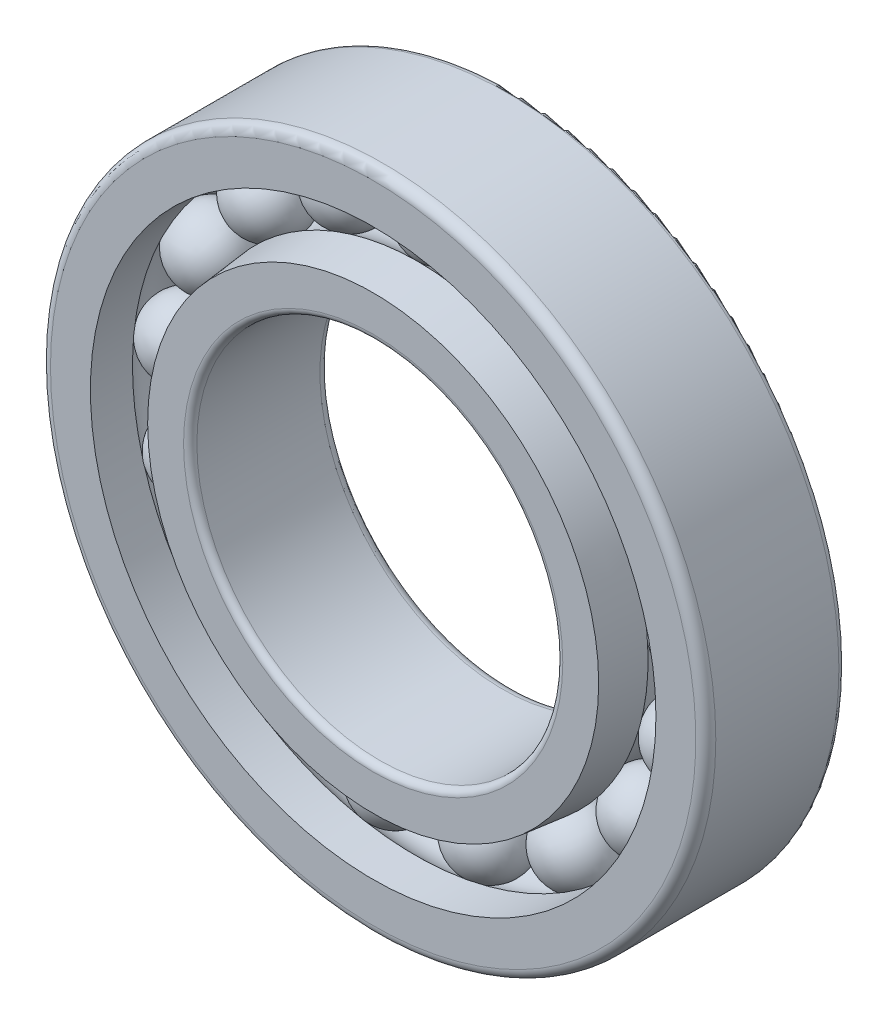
SolidWorks part; units mm, degrees
ref_plane "Front Plane" through (0, 0, 0) normal (0, 0, 1) x (1, 0, 0)
ref_plane "Top Plane" through (0, 0, 0) normal (0, 1, 0) x (1, 0, 0)
ref_plane "Right Plane" through (0, 0, 0) normal (1, 0, 0) x (0, 0, -1)
sketch "BaseSke" plane through (0, 0, 0) normal (1, 0, 0) x (0, 0, -1)
  line L0 (-47.2296, 0) -> (24.6132, 0) construction
  line L1 (-47.2296, 38.75) -> (24.6132, 38.75) construction
  line L2 (0, 129.5214) -> (0, -86.3012) construction
  line L3 (0, 44.375) -> (0, 33.125)
  line L4 (-10.5, 50) -> (10.5, 50) construction
  line L5 (-10.5, 27.5) -> (10.5, 27.5) construction
  arc A0 (0, 44.375) -> (0, 33.125) centre (0, 38.75) ccw
  dimension "Ball_diameter" = 11.25
  dimension "D1" = 38.75
  dimension "Bearing_Thickness" = 21
  dimension "Bearing_Outside_Diameter" = 100
  dimension "Bearing_Inside_Diameter" = 55
revolve "Ball" add sketch "BaseSke" angle 360 about L3
sketch "OuterRaceSke" plane through (0, 0, 0) normal (1, 0, 0) x (0, 0, -1)
  line L0 (0, 0) -> (0, 87.5396) construction
  line L1 (-10.5, 50) -> (10.5, 50)
  line L2 (-10.5, 50) -> (-10.5, 42.5)
  line L3 (-10.5, 42.5) -> (-4.1792, 42.5)
  line L4 (10.5, 50) -> (10.5, 43.6036)
  line L5 (-50.3916, 0) -> (55.2197, 0) construction
  line L6 (-47.2296, 38.75) -> (24.6132, 38.75) construction
  line L8 (10.5, 43.6036) -> (3.7847, 42.8978)
  line L9 (0, 42.5) -> (-4.1992, 58.1715) construction
  line L10 (0, 42.5) -> (3.7847, 42.8978) construction
  arc A0 (3.7847, 42.8978) -> (-4.1792, 42.5) centre (0, 38.75) ccw
  dimension "D4" = 11.23
  dimension "D2" = 85
  dimension "D3" = 6
  dimension "Angle" = 15
revolve "OuterRace" add sketch "OuterRaceSke" angle 360 about L5
sketch "InnerRaceSke" plane through (0, 0, 0) normal (1, 0, 0) x (0, 0, -1)
  line L0 (-70.8626, 0) -> (113.5527, 0) construction
  line L1 (0, 58.441) -> (0, -70.8113) construction
  line L2 (-10.5, 27.5) -> (10.5, 27.5)
  line L3 (-10.5, 27.5) -> (-10.5, 35)
  line L4 (-10.5, 35) -> (-4.1792, 35)
  line L5 (10.5, 27.5) -> (10.5, 35)
  line L6 (0, 129.5214) -> (0, -86.3012) construction
  line L7 (4.1792, 35) -> (10.5, 35)
  arc A0 (-4.1792, 35) -> (4.1792, 35) centre (0, 38.75) ccw
  arc A1 (0, 44.375) -> (0, 33.125) centre (0, 38.75) ccw construction
  dimension "D2" = 11.23
  dimension "D1" = 70
revolve "InnerRace" add sketch "InnerRaceSke" angle 360 about L0
fillet "Fillet1" radius 1.5 2 edges at (27.5, 0, -10.5) (50, 0, 10.5)
fillet "Fillet2" radius 1 2 edges at (50, 0, -10.5) (27.5, 0, 10.5)
sketch "CutInnerRaceSke" plane through (0, 0, 0) normal (1, 0, 0) x (0, 0, -1)
  line L0 (-4.1792, 35) -> (-10.5, 35)
  line L1 (-10.5, 35) -> (-10.5, 33.8964)
  line L2 (-10.5, 33.8964) -> (-3.7847, 34.6022)
  line L3 (-3.7847, 34.6022) -> (0, 35) construction
  line L4 (0, 58.441) -> (0, -70.8113) construction
  line L5 (-28.3066, 0) -> (35.2466, 0) construction
  arc A0 (-4.1792, 35) -> (-3.7847, 34.6022) centre (0, 38.75) ccw
  arc A1 (-4.1792, 35) -> (4.1792, 35) centre (0, 38.75) ccw construction
  dimension "D1" = 6
revolve "CutInnerRace" cut sketch "CutInnerRaceSke" angle 360 about L5
pattern_circular "CirPatternBall" count 17 over 360 about axis through (0, 0, 0) along (0, 0, 1) of "Ball"
sketch "SimplifiedSke" plane through (0, 0, 0) normal (1, 0, 0) x (0, 0, -1)
  line L0 (37.5911, 0) -> (-37.5911, 0) construction
  circle A0 centre (0, 38.75) radius 5.625
  arc A1 (0, 44.375) -> (0, 33.125) centre (0, 38.75) ccw construction
revolve "Simplified" [suppressed] add sketch "SimplifiedSke" angle 360 about L0
equation "\"D1@BaseSke\" =  (\"Bearing_Outside_Diameter@BaseSke\"  +  \"Bearing_Inside_Diameter@BaseSke\"  )  / 4"
equation "\"Ball_diameter@BaseSke\" =  ( \"Bearing_Outside_Diameter@BaseSke\" - \"Bearing_Inside_Diameter@BaseSke\" ) / 4 "
equation "\"D2@OuterRaceSke\" = \"Bearing_Outside_Diameter@BaseSke\" -  ( \"Bearing_Outside_Diameter@BaseSke\" - \"Bearing_Inside_Diameter@BaseSke\" )  / 3"
equation "\"D4@OuterRaceSke\" = (  \"Bearing_Outside_Diameter@BaseSke\" - \"Bearing_Inside_Diameter@BaseSke\" ) / 4 -0.02"
equation "\"D3@OuterRaceSke\" = \"Angle@OuterRaceSke\"/2.5"
equation "\"D1@InnerRaceSke\" = \"Bearing_Inside_Diameter@BaseSke\" +  ( \"Bearing_Outside_Diameter@BaseSke\" - \"Bearing_Inside_Diameter@BaseSke\" )  / 3"
equation "\"D2@InnerRaceSke\" = \"D4@OuterRaceSke\""
equation "\"D1@CirPatternBall\" = int( \"D1@BaseSke\"* pi  * 2 / \"Ball_diameter@BaseSke\"/1.2 ) -1"
equation "\"D1@CutInnerRaceSke\" = \"D3@OuterRaceSke\""
